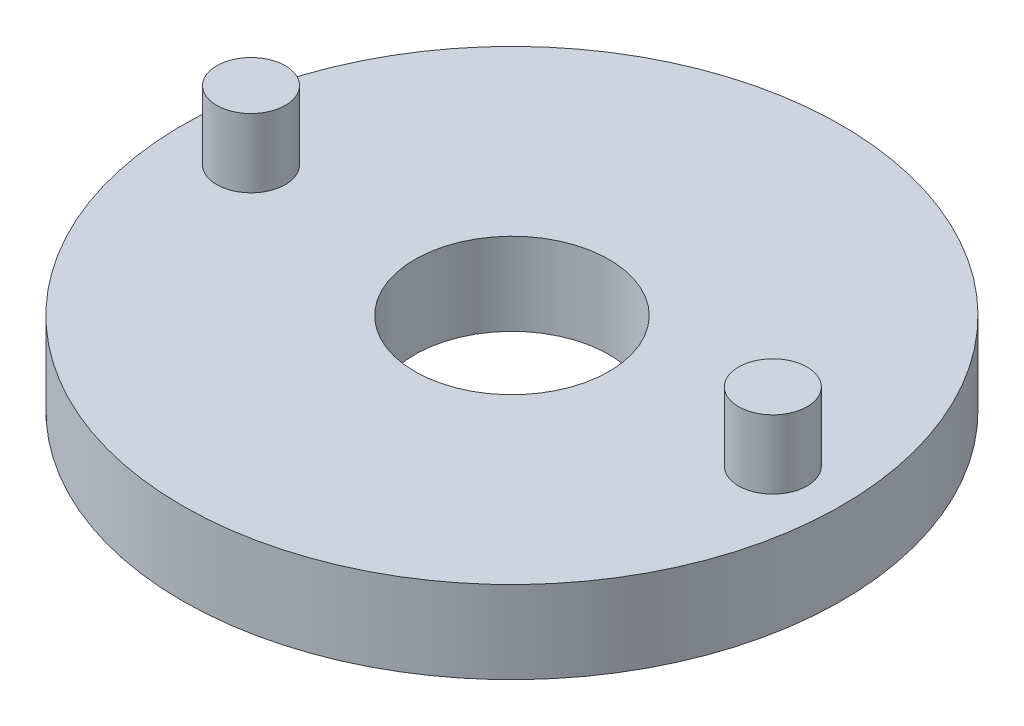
SolidWorks part; units mm, degrees
ref_plane "Front Plane" through (0, 0, 0) normal (0, 0, 1) x (1, 0, 0)
ref_plane "Top Plane" through (0, 0, 0) normal (0, 1, 0) x (1, 0, 0)
ref_plane "Right Plane" through (0, 0, 0) normal (1, 0, 0) x (0, 0, -1)
sketch "Sketch1" plane through (0, 0, 0) normal (0, 1, 0) x (1, 0, 0)
  circle A0 centre (0, 0) radius 24
  dimension "D1" = 48
extrude "Boss-Extrude1" add sketch "Sketch1" along normal blind 6
sketch "Sketch3" plane through (0, 6, 0) normal (0, 1, 0) x (1, 0, 0)
  circle A1 centre (0, 0) radius 7.0711
extrude "Cut-Extrude2" cut sketch "Sketch3" against normal blind 6
sketch "Sketch12" plane through (0, 6, 0) normal (0, 1, 0) x (1, 0, 0)
  circle A0 centre (-19, 0) radius 2.5
  circle A2 centre (19, 0) radius 2.5
  circle A4 centre (0, -19) radius 2.5
  circle A5 centre (0, 19) radius 2.5
  point P12 (0, 0)
  dimension "D1" = 5
  dimension "D2" = 19
  dimension "D3" = 4
extrude "Boss-Extrude2" add sketch "Sketch12" along normal blind 5
sketch "Sketch13" plane through (0, 0, 0) normal (0, -1, 0) x (1, 0, 0)
  circle A0 centre (0, 0) radius 10.5
  circle A1 centre (0, 0) radius 21
  dimension "D1" = 42
  dimension "D2" = 21
extrude "Cut-Extrude3" cut sketch "Sketch13" against normal blind 4
